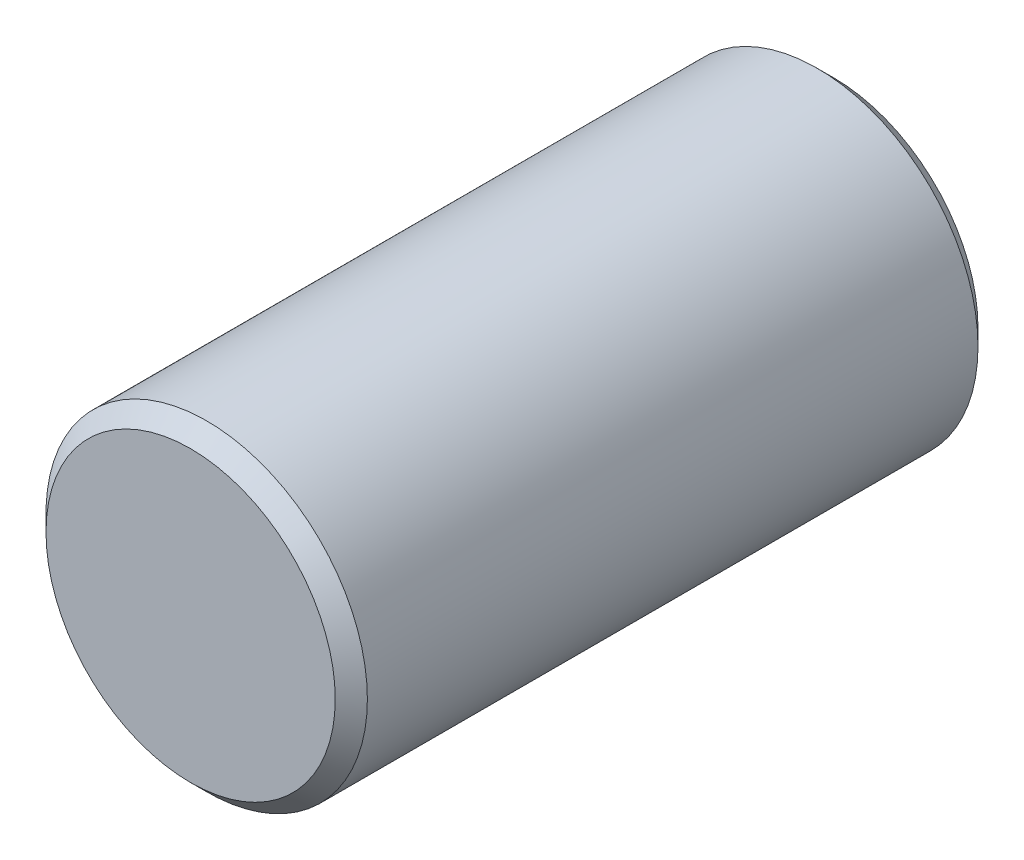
SolidWorks part; units mm, degrees
ref_plane "Face" through (0, 0, 0) normal (0, 0, 1) x (1, 0, 0)
ref_plane "Dessus" through (0, 0, 0) normal (0, 1, 0) x (1, 0, 0)
ref_plane "Droite" through (0, 0, 0) normal (1, 0, 0) x (0, 0, -1)
sketch "Esquisse1" plane through (0, 0, 0) normal (0, 0, 1) x (1, 0, 0)
  circle A0 centre (0, 0) radius 1
  dimension "D1" = 2
extrude "Extrusion1" add sketch "Esquisse1" along normal blind 4
chamfer "Chanfrein1" distance 0.1 angle 45 2 edges at (1, 0, 0) (1, 0, 4)
